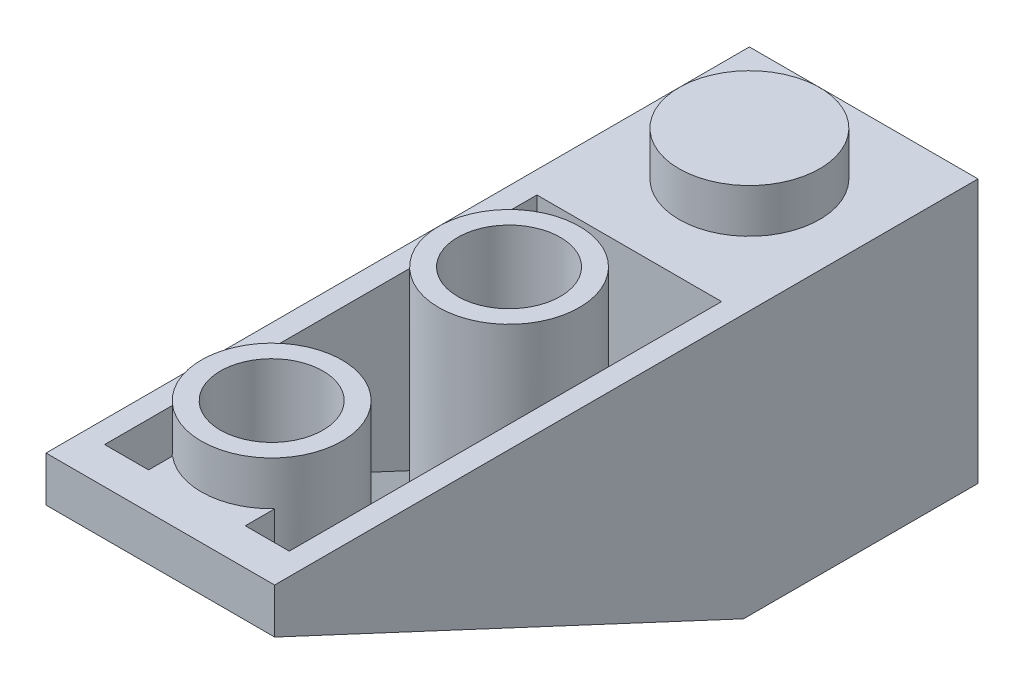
SolidWorks part; units mm, degrees
ref_plane "Face" through (0, 0, 0) normal (0, 0, 1) x (1, 0, 0)
ref_plane "Dessus" through (0, 0, 0) normal (0, 1, 0) x (1, 0, 0)
ref_plane "Droite" through (0, 0, 0) normal (1, 0, 0) x (0, 0, -1)
sketch "Esquisse1" plane through (0, 0, 0) normal (1, 0, 0) x (0, 0, -1)
  line L0 (-8, -9) -> (-24, -1.5391)
  line L1 (-8, 0) -> (0, 0)
  line L2 (0, 0) -> (0, -9)
  line L3 (0, -9) -> (-8, -9)
  line L4 (-24, 0) -> (-24, -1.5391)
  line L6 (-8, -8) -> (-8, 0)
  line L7 (-24, 0) -> (-23, 0)
  line L8 (-8, -8) -> (-23, -1.0054)
  line L12 (-23, -1.0054) -> (-23, 0)
  point P1 (-24, -9)
  point P12 (-24, -8)
  dimension "D3" = 16
extrude "Base-Extrusion" add sketch "Esquisse1" against normal blind 7.8
sketch "Esquisse2" plane through (0, 0, 0) normal (1, 0, 0) x (0, 0, -1)
  line L0 (-24, -1.5391) -> (-8, -9)
  line L1 (-24, 0) -> (0, 0)
  line L2 (-24, 0) -> (-24, -1.5391)
  line L3 (-8, -9) -> (0, -9)
  line L4 (0, 0) -> (0, -9)
  point P2 (-24, -9)
  dimension "D1" = 16
  dimension "D2" = 25
extrude "Boss.-Extru.1" add sketch "Esquisse2" against normal blind 0.75
sketch "Esquisse3" plane through (-7.8, 0, 0) normal (-1, 0, 0) x (0, 0, 1)
  line L0 (24, -1.5391) -> (8, -9)
  line L1 (24, 0) -> (0, 0)
  line L2 (24, 0) -> (24, -1.5391)
  line L3 (8, -9) -> (0, -9)
  line L4 (0, 0) -> (0, -9)
  point P2 (24, -9)
  dimension "D1" = 16
  dimension "D2" = 25
extrude "Boss.-Extru.2" add sketch "Esquisse3" against normal blind 0.75
sketch "Esquisse5" plane through (0, -9, 0) normal (0, -1, 0) x (1, 0, 0)
  line L0 (0, 8) -> (0, 0) construction
  line L1 (-1.45, 6.55) -> (-6.35, 6.55)
  line L2 (-1.45, 6.55) -> (-1.45, 1.45)
  line L3 (-1.45, 1.45) -> (-6.35, 1.45)
  line L4 (-6.35, 6.55) -> (-6.35, 1.45)
  line L5 (-7.8, 8) -> (0, 8) construction
  line L6 (-7.8, 0) -> (0, 0) construction
  line L7 (-7.8, 8) -> (-7.8, 0) construction
  dimension "D1" = 1.45
  dimension "D2" = 1.45
  dimension "D3" = 1.45
  dimension "D4" = 1.45
extrude "Enlèv. mat.-Extru.1" cut sketch "Esquisse5" against normal blind 8
sketch "Esquisse6" plane through (0, 0, 0) normal (0, 1, 0) x (-1, 0, 0)
  line L0 (7.8, 0) -> (0, 0) construction
  line L1 (0, 0) -> (0, 24) construction
  circle A0 centre (3.9, 3.9) radius 2.4
  dimension "D1" = 4.8
  dimension "D2" = 3.9
  dimension "D3" = 3.9
extrude "Boss.-Extru.6" add sketch "Esquisse6" along normal blind 1.5
sketch "Esquisse7" plane through (0, 1.5, 0) normal (0, 1, 0) x (-1, 0, 0)
  line L0 (0, 0) -> (0, 24) construction
  line L1 (7.8, 24) -> (0, 24) construction
  circle A0 centre (3.9, 12.1006) radius 2.4
  circle A1 centre (4, 20.1) radius 2.4
  circle A2 centre (3.9, 12.1006) radius 1.75
  circle A3 centre (4, 20.1) radius 1.75
  dimension "D2" = 4.8
  dimension "D3" = 4.8
  dimension "D6" = 3.5
  dimension "D7" = 3.5
  dimension "D1" = 3.9
  dimension "D4" = 8
  dimension "D5" = 3.9
extrude "Boss.-Extru.7" add sketch "Esquisse7" against normal up to surface (6.4687 mm away)
sketch "Esquisse8" plane through (0, -9, 0) normal (0, -1, 0) x (1, 0, 0)
  line L0 (-7.8, 0) -> (0, 0) construction
  line L1 (0, 24) -> (0, 8) construction
  circle A0 centre (-3.9, 12) radius 2.4
  dimension "D2" = 4.8
  dimension "D1" = 12
  dimension "D3" = 3.9
extrude "Enlèv. mat.-Extru.2" cut sketch "Esquisse8" against normal blind 1.5
sketch "Esquisse9" plane through (0, 0, 0) normal (0, 1, 0) x (-1, 0, 0)
  line L1 (0.75, 8) -> (0.75, 23) construction
  line L2 (2.25, 21.7609) -> (5.55, 21.7609)
  line L3 (2.25, 21.7609) -> (2.25, 23.6013)
  line L4 (2.25, 23.6013) -> (5.55, 23.6013)
  line L6 (5.55, 21.7609) -> (5.55, 23.6013)
  line L8 (7.05, 23) -> (7.05, 8) construction
  dimension "D1" = 1.5
  dimension "D2" = 1.5
extrude "Boss.-Extru.8" add sketch "Esquisse9" along normal up to surface (1.5832 mm away)
sketch "Esquisse10" plane through (0, 0, 0) normal (0, 1, 0) x (-1, 0, 0)
  line L0 (0.75, 8) -> (0.75, 23) construction
  line L1 (7.05, 23) -> (0.75, 23)
  line L2 (7.05, 23) -> (7.05, 22.75)
  line L3 (7.05, 22.75) -> (0.75, 22.75)
  line L4 (0.75, 23) -> (0.75, 22.75)
  dimension "D1" = 0.25
extrude "Boss.-Extru.9" add sketch "Esquisse10" against normal up to surface (1.0054 mm away)
